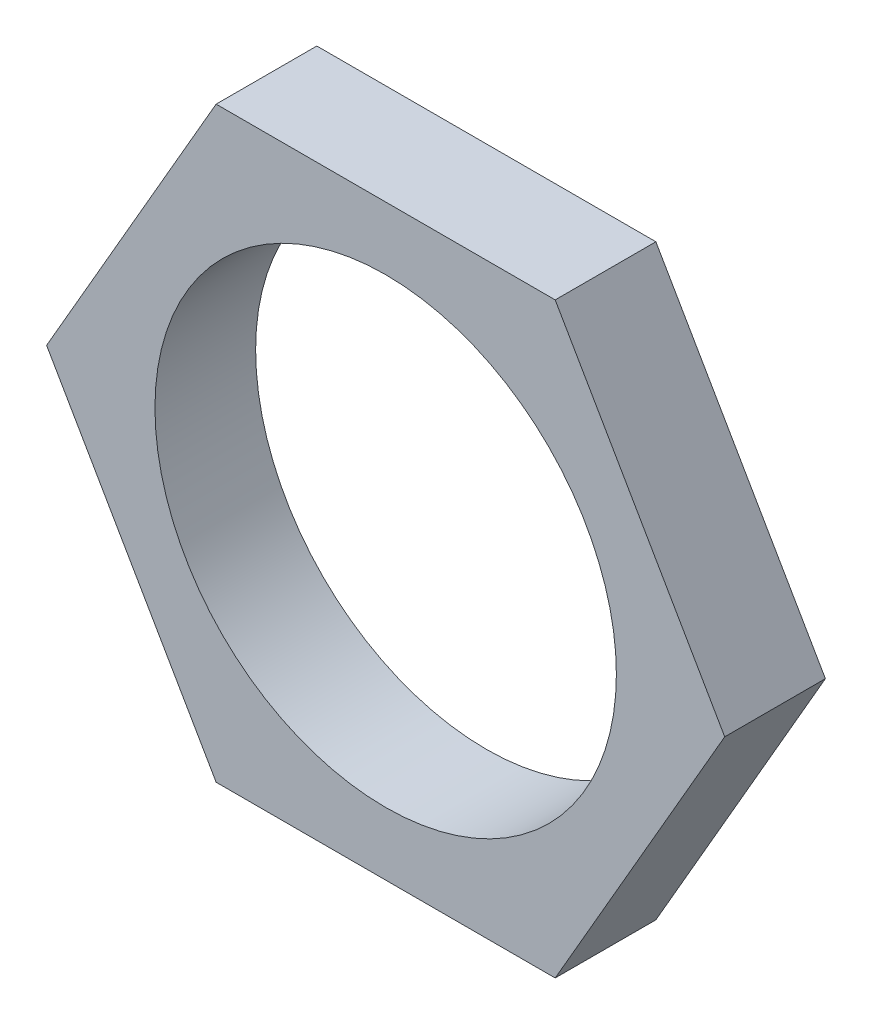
SolidWorks part; units mm, degrees
ref_plane "Přední" through (0, 0, 0) normal (0, 0, 1) x (1, 0, 0)
ref_plane "Horní" through (0, 0, 0) normal (0, 1, 0) x (1, 0, 0)
ref_plane "Pravá" through (0, 0, 0) normal (1, 0, 0) x (0, 0, -1)
sketch "Skica1" plane through (0, 0, 0) normal (0, 0, 1) x (1, 0, 0)
  line L0 (0, 0) -> (-8.0829, 0) construction
  line L1 (-8.0829, 0) -> (-4.0415, -7)
  line L2 (-4.0415, -7) -> (4.0415, -7)
  line L3 (4.0415, -7) -> (8.0829, 0)
  line L4 (8.0829, 0) -> (4.0415, 7)
  line L5 (4.0415, 7) -> (-4.0415, 7)
  line L6 (-4.0415, 7) -> (-8.0829, 0)
  circle A0 centre (0, 0) radius 7 construction
  circle A1 centre (0, 0) radius 5.5
  dimension "D2" = 11
  dimension "D1" = 14
extrude "Vysunout1" add sketch "Skica1" along normal blind 2.4
